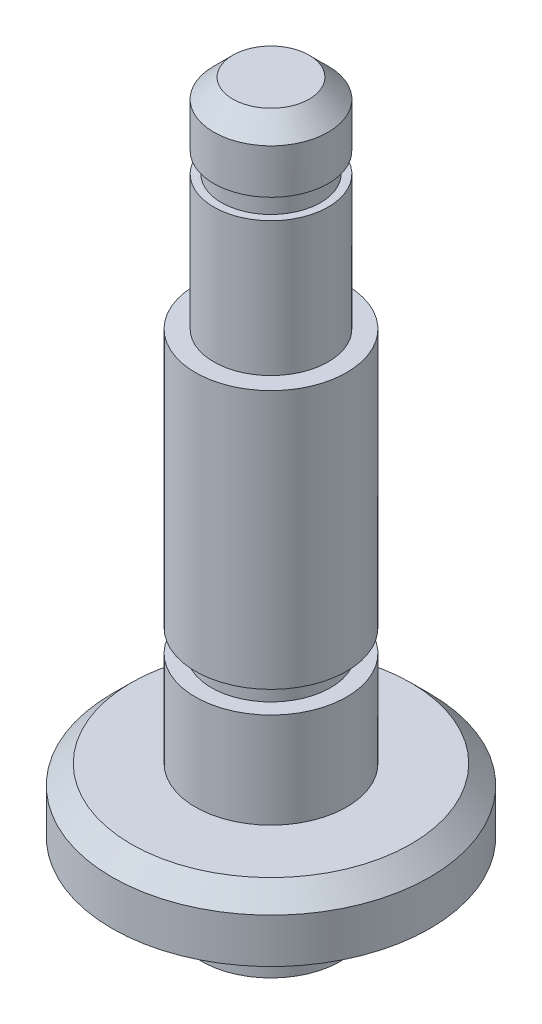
SolidWorks part; units mm, degrees
ref_plane "Front Plane" through (0, 0, 0) normal (0, 0, 1) x (1, 0, 0)
ref_plane "Top Plane" through (0, 0, 0) normal (0, 1, 0) x (1, 0, 0)
ref_plane "Right Plane" through (0, 0, 0) normal (1, 0, 0) x (0, 0, -1)
sketch "Sketch2" plane through (0, 0, 0) normal (1, 0, 0) x (0, 0, -1)
  line L0 (0, 0) -> (0, 86.5522) construction
  line L1 (2.7781, 0) -> (6.35, 0)
  line L2 (2.7781, 0) -> (2.7781, -2.921)
  line L3 (6.35, 0) -> (6.35, 2.54)
  line L4 (6.35, 2.54) -> (3.0226, 2.54)
  line L5 (3.0226, 2.54) -> (3.0226, 17.5768)
  line L6 (3.0226, 17.5768) -> (2.286, 17.5768)
  line L7 (0, 26.289) -> (0, -2.921)
  line L8 (0, -2.921) -> (2.7781, -2.921)
  line L9 (2.286, 17.5768) -> (2.286, 26.289)
  line L10 (2.286, 26.289) -> (0, 26.289)
  dimension "D1" = 6.0452
  dimension "D2" = 2.54
  dimension "D3" = 17.5768
  dimension "D4" = 12.7
  dimension "D5" = 5.5562
  dimension "D6" = 2.921
  dimension "D7" = 26.289
  dimension "D8" = 4.572
revolve "Revolve1" add sketch "Sketch2" angle 360 about L0
chamfer "Chamfer2" distance 0.762 angle 45 1 edges at (0, 2.54, -6.35)
sketch "Sketch3" plane through (0, 0, 0) normal (1, 0, 0) x (0, 0, -1)
  line L0 (3.0226, 2.54) -> (3.0226, 17.5768) construction
  line L1 (3.0226, 7.239) -> (2.3813, 7.239)
  line L2 (3.0226, 7.239) -> (3.0226, 6.35)
  line L3 (3.0226, 6.35) -> (2.3813, 6.35)
  line L4 (2.3813, 7.239) -> (2.3813, 6.35)
  line L5 (0, 0) -> (0, 16.4794) construction
  line L6 (-6.35, 0) -> (6.35, 0) construction
  dimension "D1" = 4.7625
  dimension "D2" = 0.889
  dimension "D3" = 6.35
revolve "Cut-Revolve1" cut sketch "Sketch3" angle 360 about L5
chamfer "Chamfer3" distance 0.762 angle 45 1 edges at (0, 26.289, -2.286)
sketch "Sketch4" plane through (0, 0, 0) normal (1, 0, 0) x (0, 0, -1)
  line L0 (2.286, 17.5768) -> (2.286, 25.527) construction
  line L1 (2.286, 23.7461) -> (1.9812, 23.7461)
  line L2 (2.286, 23.7461) -> (2.286, 22.9362)
  line L3 (2.286, 22.9362) -> (1.9812, 22.9362)
  line L4 (1.9812, 23.7461) -> (1.9812, 22.9362)
  line L5 (0, 0) -> (0, 26.2538) construction
  line L6 (-6.35, 0) -> (6.35, 0) construction
  dimension "D1" = 3.9624
  dimension "D2" = 0.8099
  dimension "D3" = 22.9362
revolve "Cut-Revolve2" cut sketch "Sketch4" angle 360 about L5
